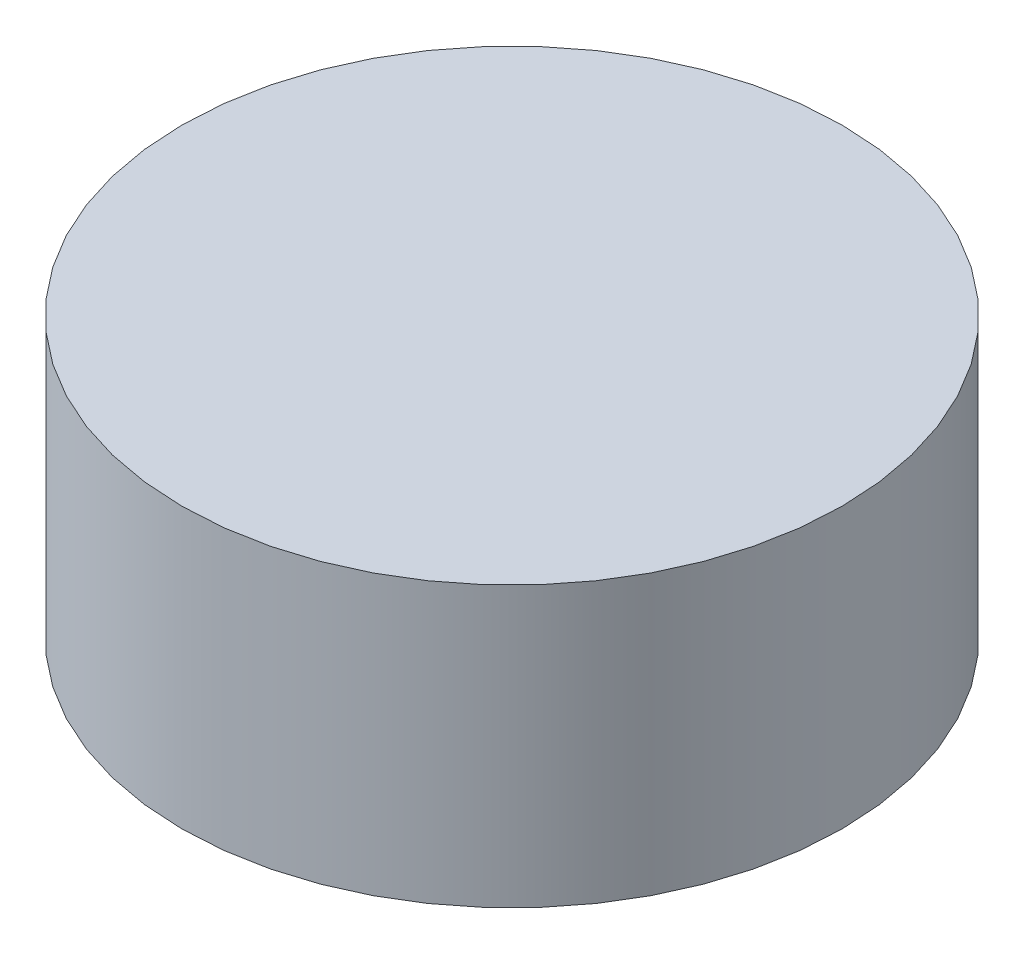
SolidWorks part; units mm, degrees
other "inverted_pendulum_nx_objects[1]"
ref_plane "Front Plane" through (0, 0, 0) normal (0, 0, 1) x (1, 0, 0)
ref_plane "Top Plane" through (0, 0, 0) normal (0, 1, 0) x (1, 0, 0)
ref_plane "Right Plane" through (0, 0, 0) normal (1, 0, 0) x (0, 0, -1)
imported_body "magnet.stp<1>"
move or copy body "Body-Move/Copy1" bodies to move or copy 101 placed by mates yes parameters "D1"=0, "D2"=0, "D3"=0
